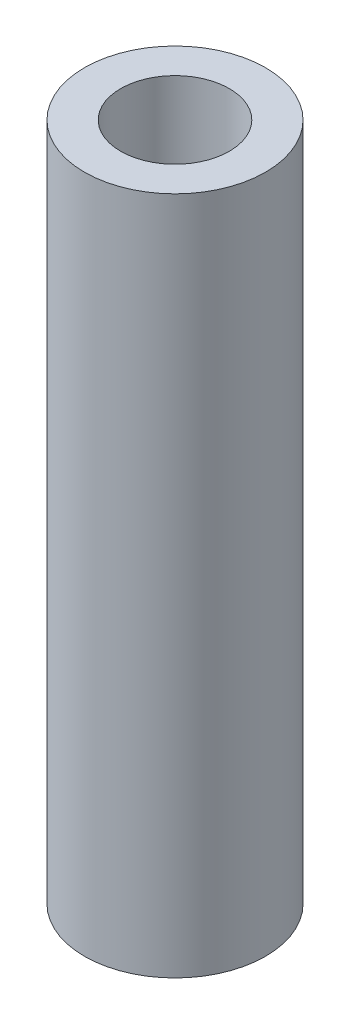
SolidWorks part; units mm, degrees
ref_plane "Front Plane" through (0, 0, 0) normal (0, 0, 1) x (1, 0, 0)
ref_plane "Top Plane" through (0, 0, 0) normal (0, 1, 0) x (1, 0, 0)
ref_plane "Right Plane" through (0, 0, 0) normal (1, 0, 0) x (0, 0, -1)
sketch "Sketch1" plane through (0, 0, 0) normal (0, 1, 0) x (1, 0, 0)
  circle A0 centre (0, 0) radius 2.032
  dimension "D1" = 4.064
extrude "Boss-Extrude1" add sketch "Sketch1" along normal blind 15.24
sketch "Sketch2" plane through (0, 15.24, 0) normal (0, 1, 0) x (1, 0, 0)
  circle A0 centre (0, 0) radius 1.143
  dimension "D1" = 2.286
hole_wizard "#2 Clearance Hole1" positions "Sketch4" profile "Sketch3" hole size "#2" standard "ANSI Inch"
sketch "Sketch4" plane through (0, 15.24, 0) normal (0, 1, 0) x (1, 0, 0)
  point P0 (0, 0)
sketch "Sketch3" plane through (0, 15.24, 0) normal (1, 0, 0) x (0, 0, 1)
  line L0 (0, 0) -> (0, 15.24)
  line L1 (0, 15.24) -> (1.2192, 15.24)
  line L2 (1.2192, 15.24) -> (1.2192, 0)
  line L5 (1.2192, 0) -> (0, 0)
  line L11 (0, -6.35) -> (0, 107.95) construction
  dimension "Thru Hole Dia." = 2.4384
  dimension "Thru Hole Depth" = 15.24
